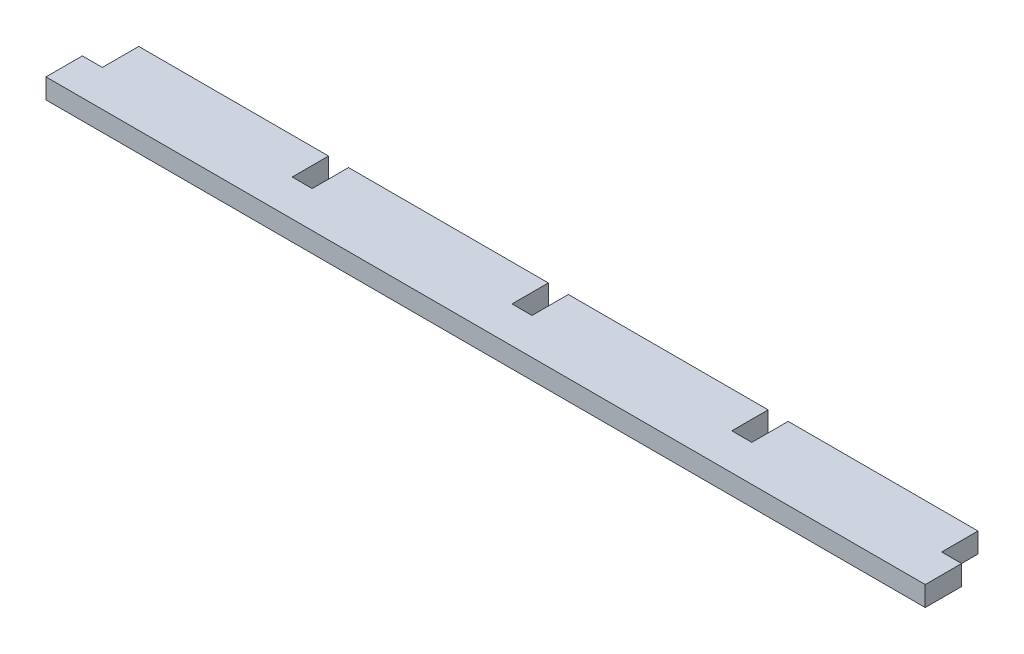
SolidWorks part; units mm, degrees
ref_plane "Front Plane" through (0, 0, 0) normal (0, 0, 1) x (1, 0, 0)
ref_plane "Top Plane" through (0, 0, 0) normal (0, 1, 0) x (1, 0, 0)
ref_plane "Right Plane" through (0, 0, 0) normal (1, 0, 0) x (0, 0, -1)
sketch "Sketch1" plane through (0, 0, 0) normal (0, 1, 0) x (1, 0, 0)
  line L0 (-279.4, 11.557) -> (0, 11.557) construction
  line L1 (0, 0) -> (-279.4, 0)
  line L2 (0, 0) -> (0, 23.114)
  line L3 (0, 23.114) -> (-279.4, 23.114)
  line L4 (-279.4, 0) -> (-279.4, 23.114)
  line L5 (-139.7, 23.114) -> (-139.7, 0) construction
  line L6 (-209.55, 23.114) -> (-209.55, 0) construction
  line L8 (-69.85, 23.114) -> (-69.85, 0) construction
  line L9 (-142.875, 23.114) -> (-136.525, 23.114)
  line L10 (-142.875, 23.114) -> (-142.875, 11.557)
  line L11 (-142.875, 11.557) -> (-136.525, 11.557)
  line L12 (-136.525, 23.114) -> (-136.525, 11.557)
  line L13 (-73.025, 23.114) -> (-66.675, 23.114)
  line L14 (-73.025, 23.114) -> (-73.025, 11.557)
  line L15 (-73.025, 11.557) -> (-66.675, 11.557)
  line L16 (-66.675, 23.114) -> (-66.675, 11.557)
  line L17 (-212.725, 23.114) -> (-206.375, 23.114)
  line L18 (-212.725, 23.114) -> (-212.725, 11.557)
  line L19 (-212.725, 11.557) -> (-206.375, 11.557)
  line L20 (-206.375, 23.114) -> (-206.375, 11.557)
  line L21 (-279.4, 23.114) -> (-273.05, 23.114)
  line L22 (-279.4, 23.114) -> (-279.4, 11.557)
  line L23 (-279.4, 11.557) -> (-273.05, 11.557)
  line L24 (-273.05, 23.114) -> (-273.05, 11.557)
  line L25 (0, 23.114) -> (-6.35, 23.114)
  line L26 (0, 23.114) -> (0, 11.557)
  line L27 (0, 11.557) -> (-6.35, 11.557)
  line L28 (-6.35, 23.114) -> (-6.35, 11.557)
  dimension "D1" = 279.4
  dimension "D2" = 23.114
  dimension "D3" = 69.85
  dimension "D4" = 69.85
  dimension "D5" = 3.175
  dimension "D6" = 3.175
  dimension "D7" = 3.175
  dimension "D8" = 3.175
  dimension "D9" = 3.175
  dimension "D10" = 3.175
  dimension "D11" = 6.35
  dimension "D12" = 6.35
extrude "Boss-Extrude1" add sketch "Sketch1" along normal blind 6.35 contours L3 L20 L19 L18 L4 L1 L2 L16 L15 L14 L12 L11 L10
